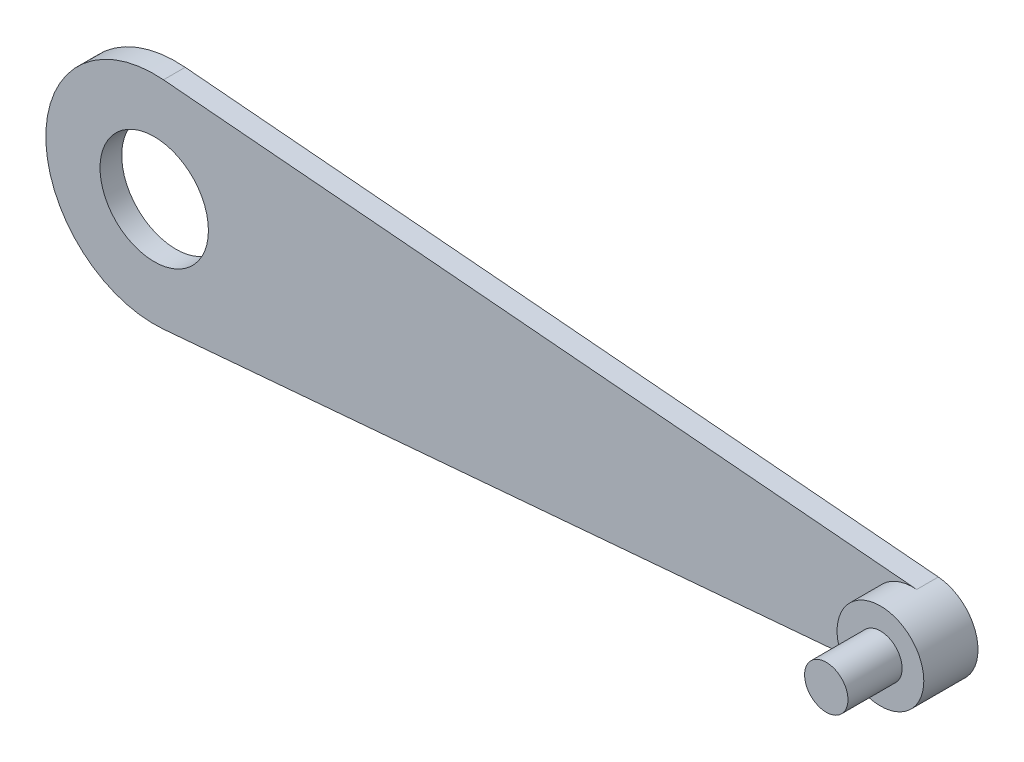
SolidWorks part; units mm, degrees
ref_plane "Front" through (0, 0, 0) normal (0, 0, 1) x (1, 0, 0)
ref_plane "Top" through (0, 0, 0) normal (0, 1, 0) x (1, 0, 0)
ref_plane "Right" through (0, 0, 0) normal (1, 0, 0) x (0, 0, -1)
sketch "Sketch1" plane through (0, 0, 0) normal (0, 0, 1) x (1, 0, 0)
  circle A0 centre (0, 0) radius 2.5
  circle A1 centre (0, 0) radius 5
extrude "Extrude1" add sketch "Sketch1" along normal blind 1
sketch "Sketch2" plane through (0, 0, 0) normal (0, 0, 1) x (1, 0, 0)
  line L0 (0, 0) -> (35, 0) construction
  circle A0 centre (35, 0) radius 2
  dimension "D1" = 35
extrude "Extrude2" add sketch "Sketch2" along normal blind 2.5
sketch "Sketch3" plane through (0, 0, 2.5) normal (0, 0, 1) x (1, 0, 0)
  circle A0 centre (35, 0) radius 1
  dimension "D1" = 2
extrude "Extrude3" add sketch "Sketch3" along normal blind 2.5
sketch "Sketch4" plane through (0, 0, 0) normal (0, 0, 1) x (1, 0, 0)
  line L0 (0.4286, 4.9816) -> (35.1714, 1.9926)
  line L1 (0.4286, -4.9816) -> (35.1714, -1.9926)
  arc A0 (0.4286, -4.9816) -> (0.4286, 4.9816) centre (0, 0) ccw
  arc A1 (35.1714, 1.9926) -> (35.1714, -1.9926) centre (35, 0) ccw
  dimension "D1" = 10
  dimension "D2" = 4
extrude "Extrude4" add sketch "Sketch4" along normal blind 1
